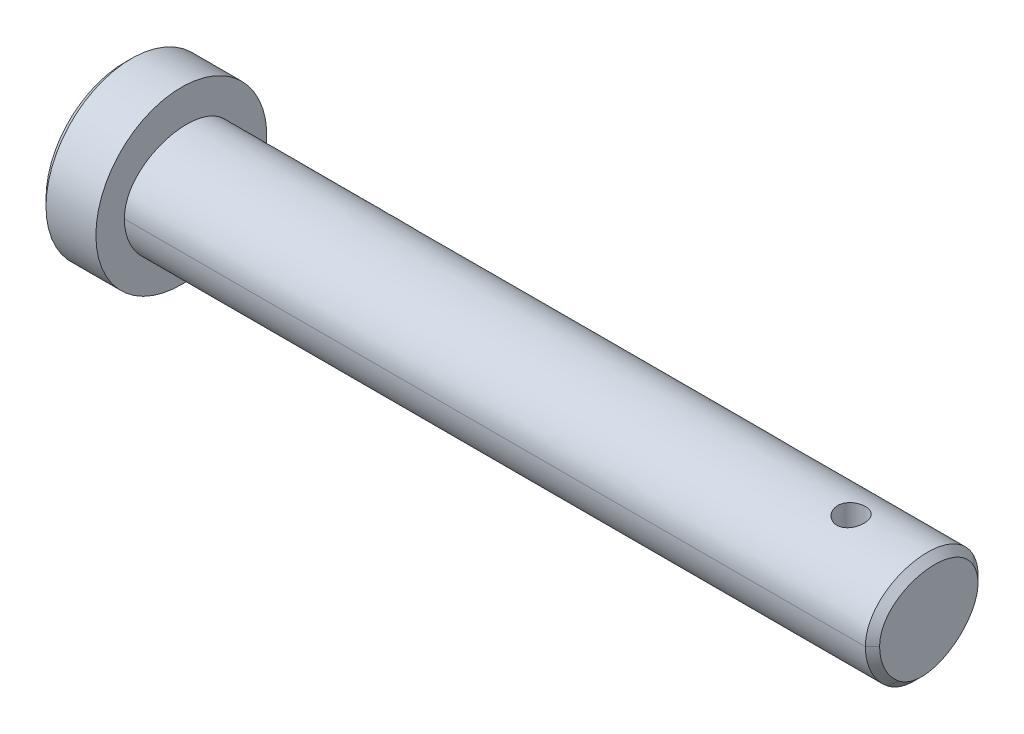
SolidWorks part; units mm, degrees
ref_plane "Front Plane" through (0, 0, 0) normal (0, 0, 1) x (1, 0, 0)
ref_plane "Top Plane" through (0, 0, 0) normal (0, 1, 0) x (1, 0, 0)
ref_plane "Right Plane" through (0, 0, 0) normal (1, 0, 0) x (0, 0, -1)
ref_plane "Plane1" through (0, 0, 0) normal (0, 0, -1) x (-1, 0, 0)
sketch "Sketch1" plane through (0, 0, 0) normal (0, 0, -1) x (-1, 0, 0)
  line L0 (-29.9222, 6) -> (-29.9222, 0)
  line L1 (-29.9222, 0) -> (-25.9222, 0)
  line L2 (-25.9222, 0) -> (-25.9222, 6)
  line L3 (-25.9222, 6) -> (-29.9222, 6)
  line L4 (-29.9244, 0) -> (-25.9221, 0) construction
revolve "Revolve1" add sketch "Sketch1" angle 360 about L4
sketch "Sketch2" plane through (29.9222, 0, 0) normal (1, 0, 0) x (0, 0, -1)
  spline S0 degree 3 poles (-2.4532, -3.1594) (0.3758, -5.3561) (5.1675, -1.4581) (3.5926, 1.7589) knots 0 0 0 0 1 1 1 1
  spline S1 degree 3 poles (-4, 0) (-4, -1.2141) (-3.4122, -2.4148) (-2.4532, -3.1594) knots 0 0 0 0 1 1 1 1
  spline S2 degree 3 poles (3.5926, 1.7589) (2.0176, 4.9758) (-4, 3.5818) (-4, 0) knots 0 0 0 0 1 1 1 1
extrude "Boss-Extrude1" add sketch "Sketch2" along normal blind 52.5
ref_plane "Plane2" through (0, 4.0001, 0) normal (0, 1, 0) x (1, 0, 0)
hole_wizard "Ø2.0 (2) Diameter Hole1" positions "Sketch4" profile "Sketch3" hole size "Ø2.0" standard "ANSI Metric"
sketch "Sketch4" plane through (0, 4.0001, 0) normal (0, 1, 0) x (1, 0, 0)
  point P0 (76.9222, 0)
sketch "Sketch3" plane through (76.9222, 4.0001, 0) normal (1, 0, 0) x (0, 0, 1)
  line L0 (0, 0) -> (0, 10.0001)
  line L1 (0, 10.0001) -> (1, 10.0001)
  line L2 (1, 10.0001) -> (1, 0)
  line L5 (1, 0) -> (0, 0)
  line L11 (0, -6.35) -> (0, 107.95) construction
  dimension "Thru Hole Dia." = 2
  dimension "Thru Hole Depth" = 10.0001
chamfer "Chamfer1" distance 0.5 angle 45 4 edges at (25.9222, 0, 6)
